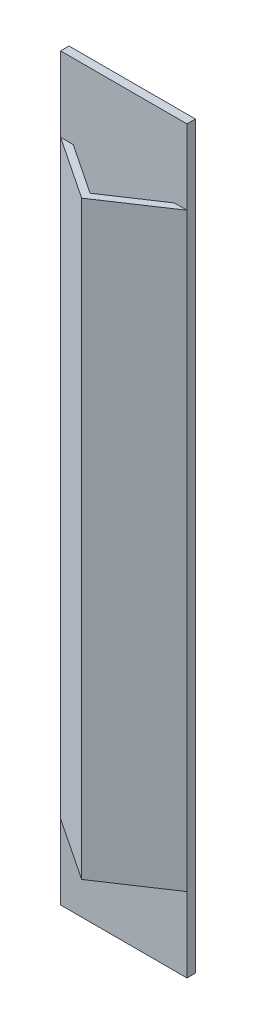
SolidWorks part; units mm, degrees
ref_plane "Front Plane" through (0, 0, 0) normal (0, 0, 1) x (1, 0, 0)
ref_plane "Top Plane" through (0, 0, 0) normal (0, 1, 0) x (1, 0, 0)
ref_plane "Right Plane" through (0, 0, 0) normal (1, 0, 0) x (0, 0, -1)
sketch "Sketch1" plane through (0, 0, 0) normal (0, 0, 1) x (1, 0, 0)
  line L0 (-1.905, 11.1443) -> (1.905, -11.1442) construction
  line L1 (-1.905, 11.1443) -> (1.905, 11.1443)
  line L2 (-1.905, 11.1443) -> (-1.905, -11.1442)
  line L3 (-1.905, -11.1442) -> (1.905, -11.1442)
  line L4 (1.905, 11.1443) -> (1.905, -11.1442)
  dimension "D1" = 3.81
  dimension "D2" = 22.2885
extrude "Arm" add sketch "Sketch1" against normal blind 0.254
sketch "Sketch2" plane through (0, 0, 0) normal (0, 1, 0) x (1, 0, 0)
  line L0 (-1.905, 0) -> (0, -1.27)
  line L1 (0, -1.27) -> (1.905, 0)
  line L2 (1.905, 0) -> (1.905, 0.254)
  line L3 (1.905, 0.254) -> (0, -1.016)
  line L4 (0, -1.016) -> (-1.905, 0.254)
  line L5 (-1.905, 0.254) -> (-1.905, 0)
  line L6 (-1.905, 0) -> (1.905, 0) construction
  dimension "D1" = 1.27
extrude "Cord Cover" add sketch "Sketch2" along normal mid plane 17.78
